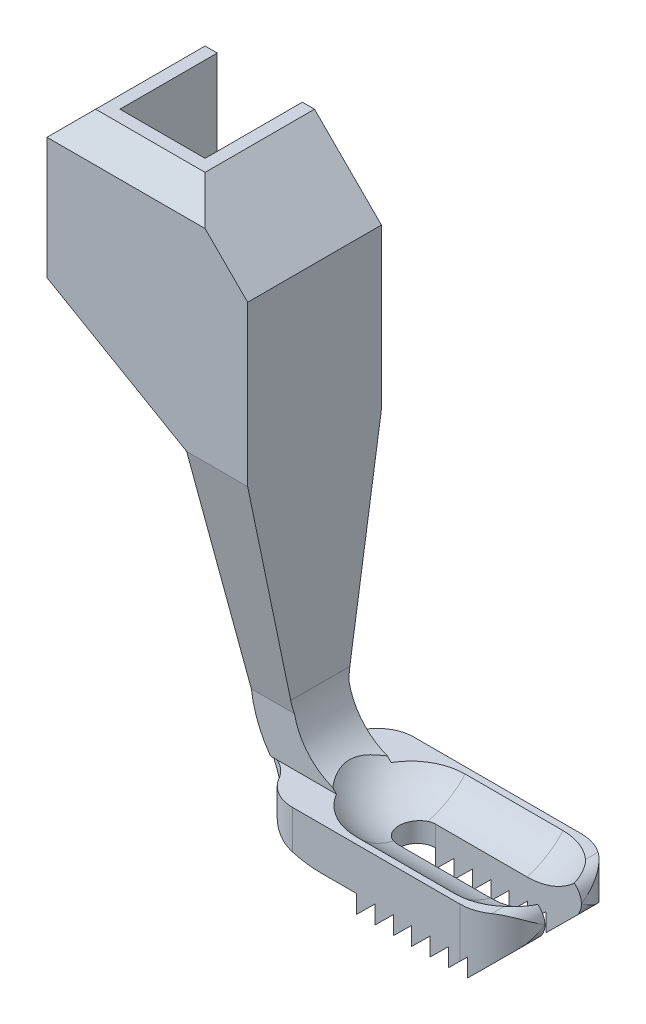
SolidWorks part; units mm, degrees
ref_plane "Ebene vorne" through (0, 0, 0) normal (0, 0, 1) x (1, 0, 0)
ref_plane "Ebene oben" through (0, 0, 0) normal (0, 1, 0) x (1, 0, 0)
ref_plane "Ebene rechts" through (0, 0, 0) normal (1, 0, 0) x (0, 0, -1)
sketch "Skizze1" plane through (0, 0, 0) normal (0, 0, 1) x (1, 0, 0)
  line L0 (0, -8.5) -> (2.9429, -8.5)
  line L1 (2.9429, -8.5) -> (2.9429, -10)
  line L2 (2.9429, -10) -> (4.4588, -8.5)
  line L3 (4.4588, -8.5) -> (4.4588, -10)
  line L4 (4.4588, -10) -> (5.9748, -8.5)
  line L5 (5.9748, -8.5) -> (5.9748, -10)
  line L6 (5.9748, -10) -> (7.4907, -8.5)
  line L7 (7.4907, -8.5) -> (7.4907, -10)
  line L8 (7.4907, -10) -> (9.0066, -8.5)
  line L9 (9.0066, -8.5) -> (9.0066, -10)
  line L10 (9.0066, -10) -> (10.5225, -8.5)
  line L11 (10.5225, -8.5) -> (10.5225, -10)
  line L12 (10.5225, -10) -> (12.0384, -8.5)
  line L13 (12.0384, -8.5) -> (12.0384, -10)
  line L14 (12.0384, -10) -> (14.498, -7.5662)
  line L15 (13.4429, -5) -> (0, -5)
  line L17 (0, -5) -> (-6.8739, -5)
  line L19 (-22.9299, -1) -> (25.7656, -1) construction
  arc A0 (-6.8739, -5) -> (0, -8.5) centre (0, 0) ccw
  arc A1 (-8.441, -1) -> (0, -8.5) centre (0, 0) ccw construction
  arc A2 (14.498, -7.5662) -> (13.4429, -5) centre (13.4429, -6.5) ccw
  arc A3 (-4.899, -1) -> (0, -5) centre (0, 0) ccw construction
  dimension "D3" = 1.5
  dimension "D4" = 8.5
  dimension "D5" = 5
  dimension "D1" = 1.5
  dimension "D2" = 12
  dimension "D6" = 9
  dimension "D7" = 13.4429
extrude "Linear austragen1" add sketch "Skizze1" along normal blind 10
sketch "Skizze2" plane through (0, -5, 0) normal (0, 1, 0) x (1, 0, 0)
  line L0 (14.9429, -5) -> (2.9429, -5) construction
  line L1 (14.9429, -10) -> (14.9429, 0) construction
  line L12 (14.9429, -10) -> (14.9429, 0) construction
  line L21 (14.9429, -3.5) -> (2.9429, -3.5)
  line L22 (2.9429, -6.5) -> (14.9429, -6.5)
  line L23 (14.9429, -3.5) -> (14.9429, -6.5)
  arc A0 (2.9429, -3.5) -> (2.9429, -6.5) centre (2.9429, -5) ccw
  dimension "D1" = 3
  dimension "D2" = 13.5
extrude "Linear austragen2" cut sketch "Skizze2" against normal through all
sketch "Skizze3" plane through (0, -5, 0) normal (0, 1, 0) x (1, 0, 0)
  line L0 (-6.8739, -5) -> (17.6853, -5) construction
  line L1 (14.9429, 0) -> (14.9429, -3.5)
  line L2 (-6.8739, -10) -> (-6.8739, -7.0707)
  line L3 (-6.8739, -10) -> (-6.8739, 0) construction
  line L4 (2.9429, -3.5) -> (13.4429, -3.5) construction
  line L5 (14.9429, -3.5) -> (14.9429, 0) construction
  line L6 (13.4429, 0) -> (-6.8739, 0) construction
  line L7 (14.9429, 0) -> (11.4429, 0)
  line L8 (-5.8845, -3.1651) -> (-2.1129, 3.3675) construction
  line L9 (14.9429, -10) -> (11.4429, -10)
  line L10 (14.9429, -10) -> (14.9429, -6.5)
  line L11 (-2.325, 0) -> (-6.8739, 0)
  line L12 (-2.325, -10) -> (-6.8739, -10)
  line L21 (-6.8739, 0) -> (-6.8739, -2.9293)
  arc A0 (14.9429, -3.5) -> (11.4429, 0) centre (11.4429, -3.5) ccw
  arc A1 (-6.8739, -2.9293) -> (-4.9231, -1.5) centre (-7.5212, 0) ccw
  arc A2 (-2.325, 0) -> (-4.9231, -1.5) centre (-2.325, -3) ccw
  arc A3 (-2.325, -10) -> (-4.9231, -8.5) centre (-2.325, -7) cw
  arc A4 (-6.8739, -7.0707) -> (-4.9231, -8.5) centre (-7.5212, -10) cw
  arc A5 (14.9429, -6.5) -> (11.4429, -10) centre (11.4429, -6.5) cw
  point P23 (-4.0571, 0)
  point P33 (-4.0571, -10)
  dimension "D2" = 19
  dimension "D1" = 3
extrude "Linear austragen8" cut sketch "Skizze3" against normal through all
ref_plane "Ebene1" through (0, 0, 5) normal (0, 0, 1) x (1, 0, 0)
sketch "Skizze5" plane through (0, 0, 5) normal (0, 0, 1) x (1, 0, 0)
  line L0 (0, -5) -> (-6.8739, -5)
  line L1 (-8.441, -1) -> (-4.899, -1)
  line L4 (11.4429, -5) -> (-2.325, -5) construction
  arc A0 (-8.441, -1) -> (-6.8739, -5) centre (0, 0) ccw
  arc A1 (-4.899, -1) -> (0, -5) centre (0, 0) ccw
  arc A2 (-6.8739, -5) -> (-4.9231, -6.9292) centre (0, 0) ccw construction
  dimension "D1" = 5
  dimension "D2" = 9
extrude "Linear austragen9" add sketch "Skizze5" along normal blind 2.25 and the other way blind 2.25
ref_plane "Ebene3" through (0, 0, 5.5) normal (0, 0, -1) x (-1, 0, 0)
sketch "Skizze7" plane through (0, 0, 5.5) normal (0, 0, -1) x (-1, 0, 0)
  line L0 (5, 30.1281) -> (5, 0)
  line L1 (10.0198, 17) -> (8.4677, -0.7408)
  line L2 (10.0198, 17) -> (21.5, 23.6281)
  line L3 (6.3222, -5) -> (6.8739, -5)
  line L4 (0, -5) -> (6.3222, -5)
  line L5 (8.441, -1) -> (4.899, -1)
  line L6 (6.3222, -5) -> (6.8739, -5) construction
  line L7 (0, -5) -> (6.3222, -5) construction
  line L8 (8.441, -1) -> (4.899, -1)
  line L9 (21.5, 23.6281) -> (21.5, 35.6281)
  line L10 (21.5, 35.6281) -> (10.5, 35.6281)
  line L11 (10.5, 35.6281) -> (5, 30.1281)
  arc A0 (8.441, -1) -> (8.4677, -0.7408) centre (0, 0) ccw
  arc A1 (4.899, -1) -> (5, 0) centre (0, 0) ccw
  arc A2 (6.8739, -5) -> (8.441, -1) centre (0, 0) ccw
  arc A3 (0, -5) -> (4.899, -1) centre (0, 0) ccw
  arc A4 (6.8739, -5) -> (8.441, -1) centre (0, 0) ccw construction
  arc A5 (0, -5) -> (4.899, -1) centre (0, 0) ccw construction
  dimension "D2" = 5
  dimension "D3" = 30
  dimension "D4" = 27
  dimension "D5" = 12
  dimension "D6" = 16.5
  dimension "D7" = 45
  dimension "D8" = 11
  dimension "D1" = 0
extrude "Linear austragen10" add sketch "Skizze7" along normal blind 5.5 and the other way blind 5.5
sketch "Skizze9" plane through (-5, 0, 0) normal (1, 0, 0) x (0, 0, -1)
  line L0 (-7.25, -1) -> (-11, 17)
  line L2 (0, 17) -> (-2.75, -1)
  line L3 (0, 30.1281) -> (0, 0) construction
  line L4 (-11, 30.1281) -> (-11, 0) construction
  line L5 (-11, 17) -> (-11, -1)
  line L6 (-11, -1) -> (-7.25, -1)
  line L7 (0, 17) -> (0, -1)
  line L8 (0, -1) -> (-2.75, -1)
  dimension "D1" = 27
extrude "Linear austragen11" cut sketch "Skizze9" against normal through all and the other way through all
sketch "Skizze13" plane through (0, 35.6281, 0) normal (0, 1, 0) x (1, 0, 0)
  line L0 (-21.5, 0) -> (-10.5, 0) construction
  line L1 (-18.5, 0) -> (-11.5, 0)
  line L2 (-18.5, 0) -> (-18.5, -8)
  line L3 (-18.5, -8) -> (-11.5, -8)
  line L4 (-11.5, 0) -> (-11.5, -8)
  line L5 (2.9429, -5) -> (-26.5818, -5) construction
  line L7 (-21.5, -11) -> (-21.5, 0) construction
  dimension "D1" = 7
  dimension "D2" = 3
  dimension "D3" = 3
extrude "Linear austragen13" cut sketch "Skizze13" against normal through all
chamfer "Fase1" distance 2 angle 45 2 edges at (-21.5, 35.6281, 5.5) (-16, 35.6281, 11)
sketch "Skizze14" plane through (0, 0, 5) normal (0, 0, 1) x (1, 0, 0)
  line L0 (2.4151, -1) -> (44.5663, -1) construction
  line L1 (2.4151, -7) -> (10.4708, -7)
  line L2 (16.4708, -1) -> (-3.5849, -1)
  line L3 (0, -5) -> (1.4429, -5)
  line L4 (0, -5) -> (1.4429, -5) construction
  line L5 (1.4429, -5) -> (20.5332, -5) construction
  arc A0 (-3.5849, -1) -> (2.4151, -7) centre (2.4151, -1) ccw
  arc A1 (10.4708, -7) -> (16.4708, -1) centre (10.4708, -1) ccw
  arc A3 (14.498, -7.5662) -> (14.9429, -6.5) centre (13.4429, -6.5) ccw construction
  arc A4 (14.9429, -6.5) -> (13.4429, -5) centre (13.4429, -6.5) ccw construction
  point P1 (-2.0571, -5)
  point P4 (14.9429, -5)
  point P10 (14.9429, -6.5)
  dimension "D3" = 6
  dimension "D1" = 3
  dimension "D2" = 17
revolve "Schnitt-Rotation1" cut sketch "Skizze14" angle 360 about L0
